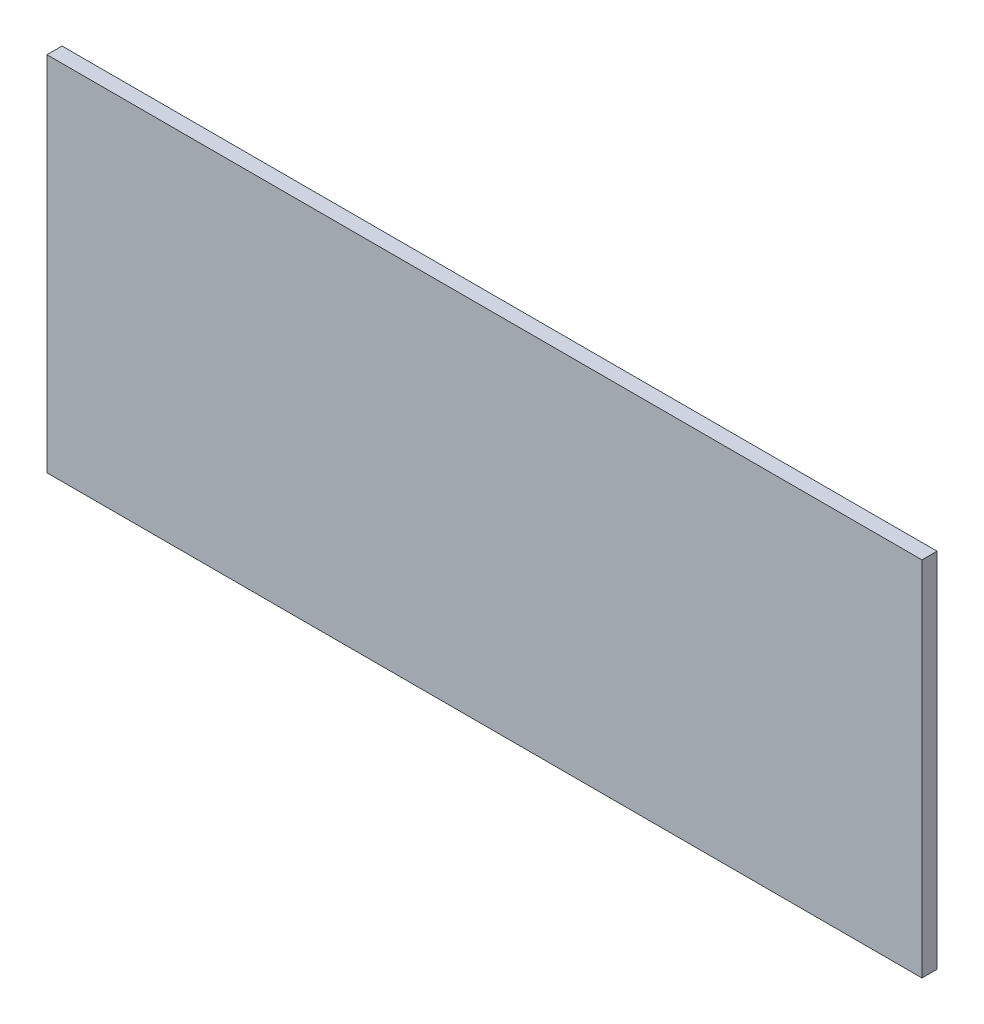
SolidWorks part; units mm, degrees
ref_plane "Front Plane" through (0, 0, 0) normal (0, 0, 1) x (1, 0, 0)
ref_plane "Top Plane" through (0, 0, 0) normal (0, 1, 0) x (1, 0, 0)
ref_plane "Right Plane" through (0, 0, 0) normal (1, 0, 0) x (0, 0, -1)
sketch "Sketch1" plane through (0, 0, 0) normal (0, 0, 1) x (1, 0, 0)
  line L1 (0, 0) -> (1104.9, 0)
  line L2 (0, 0) -> (0, 457.2)
  line L3 (0, 457.2) -> (1104.9, 457.2)
  line L4 (1104.9, 0) -> (1104.9, 457.2)
  dimension "D1" = 457.2
  dimension "D2" = 1104.9
extrude "Extrude1" add sketch "Sketch1" along normal blind 19.05
